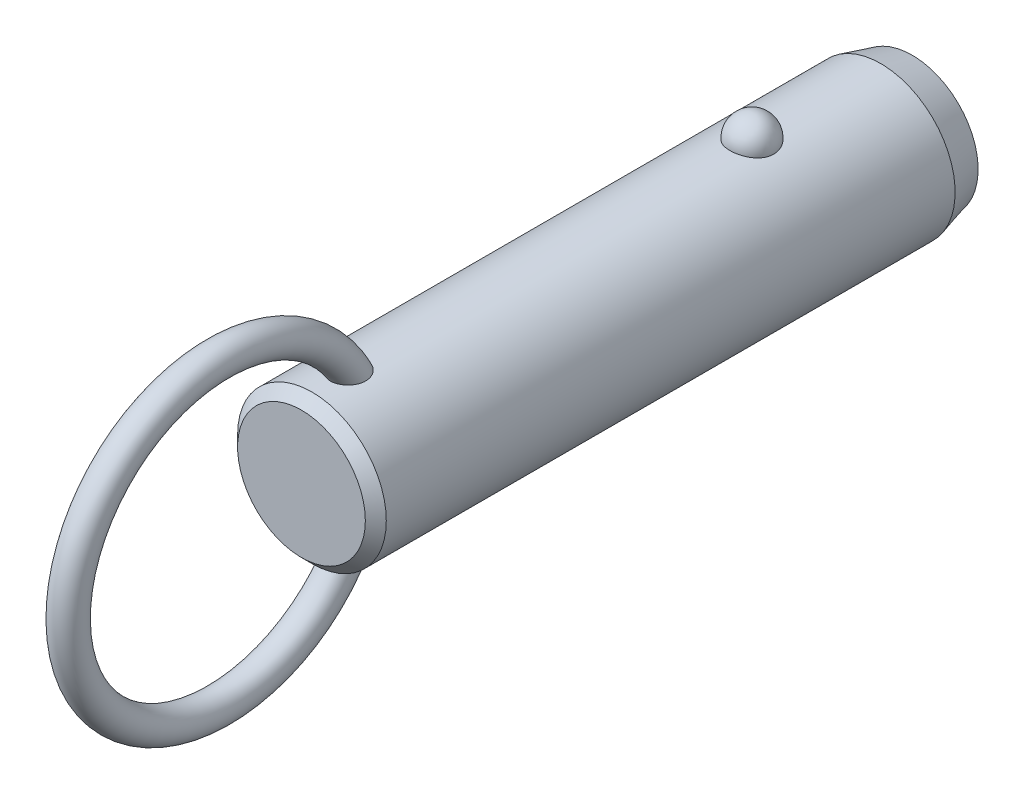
SolidWorks part; units mm, degrees
ref_plane "Front Plane" through (0, 0, 0) normal (0, 0, 1) x (1, 0, 0)
ref_plane "Top Plane" through (0, 0, 0) normal (0, 1, 0) x (1, 0, 0)
ref_plane "Right Plane" through (0, 0, 0) normal (1, 0, 0) x (0, 0, -1)
sketch "Sketch2" plane through (0, 0, 0) normal (0, 0, 1) x (1, 0, 0)
  circle A0 centre (0, 0) radius 7.1
  point P3 (0, 7.1)
  dimension "D1" = 14.2
extrude "Boss-Extrude1" add sketch "Sketch2" along normal blind 33
sketch "Sketch3" plane through (0, 0, 0) normal (0, 0, -1) x (-1, 0, 0)
  circle A0 centre (0, 0) radius 7.1
  dimension "D1" = 14.2
extrude "Boss-Extrude2" add sketch "Sketch3" along normal blind 17.4
chamfer "Chamfer1" distance 3 angle 15 1 edges at (-7.1, 0, -17.4)
sketch "Sketch12" plane through (0, 0, 0) normal (1, 0, 0) x (0, 0, -1)
  line L0 (-33, 7.1) -> (-33, -7.1) construction
  point P0 (-33, 0)
sketch "Sketch13" plane through (0, 0, 0) normal (1, 0, 0) x (0, 0, -1)
  circle A0 centre (-48.85, 0) radius 15.85
  point P2 (-33, 0)
  dimension "D1" = 31.7
sketch "Sketch14" plane through (0, 0, 0) normal (0, 1, 0) x (1, 0, 0)
  circle A0 centre (0, -34.5) radius 1.5
  point P2 (0, -33)
  dimension "D1" = 3
sweep "Sweep1" add profiles "Sketch14" path "Sketch13"
sketch "Sketch15" plane through (0, 0, 33) normal (0, 0, 1) x (1, 0, 0)
  circle A0 centre (0, 0) radius 7.1
  dimension "D1" = 14.2
extrude "Boss-Extrude3" add sketch "Sketch15" along normal blind 7.92
chamfer "Chamfer2" distance 1 angle 45 1 edges at (7.1, 0, 40.92)
sketch "Sketch18" plane through (0, 0, 0) normal (1, 0, 0) x (0, 0, -1)
  line L0 (14.4, 7.1) -> (-34.6792, 7.1) construction
  line L1 (2.1, 9.2) -> (2.1, 5)
  line L2 (-34.6792, -7.1) -> (14.4, -7.1) construction
  arc A0 (2.1, 9.2) -> (2.1, 5) centre (2.1, 7.1) ccw
  point P4 (0, 7.1)
  dimension "D1" = 16.3
revolve "Revolve1" add sketch "Sketch18" angle 360 about L1
